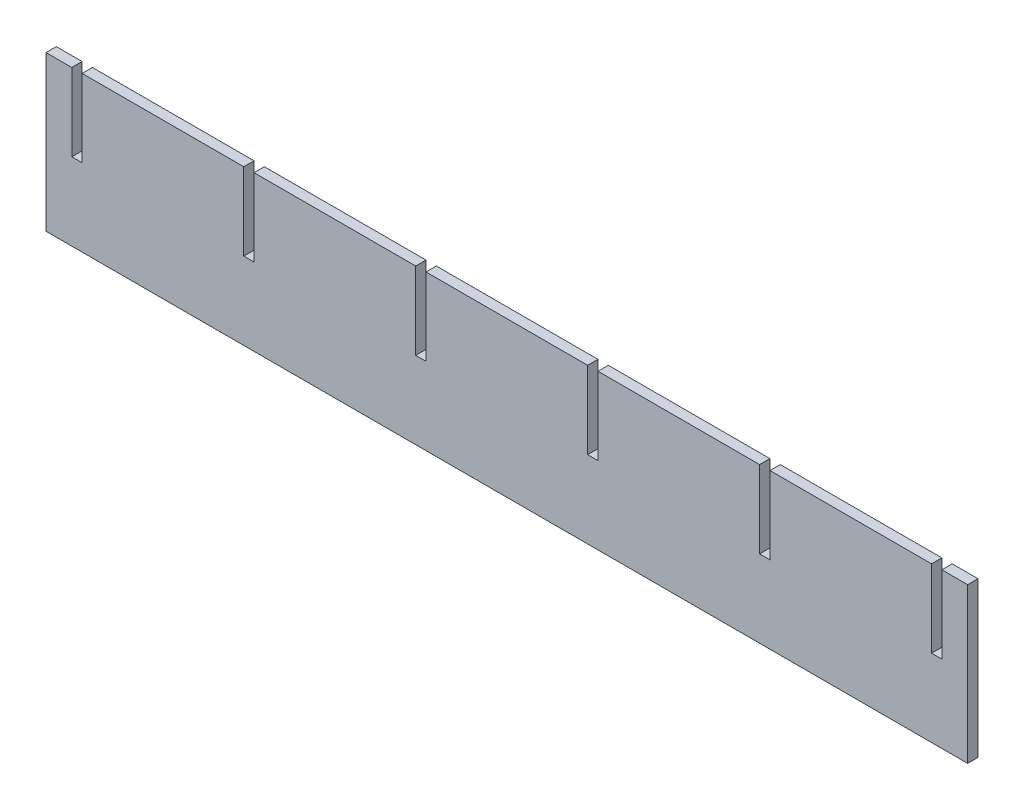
SolidWorks part; units mm, degrees
ref_plane "Alzado" through (0, 0, 0) normal (1, 0, 0) x (0, 1, 0)
ref_plane "Planta" through (0, 0, 0) normal (0, 0, 1) x (0, 1, 0)
ref_plane "Vista lateral" through (0, 0, 0) normal (0, 1, 0) x (-1, 0, 0)
sketch "Sketch3" plane through (0, 0, 0) normal (0, 0, 1) x (0, 1, 0)
  line L0 (90, -294) -> (90, -306)
  line L1 (-90, 536) -> (90, 536)
  line L2 (-90, 536) -> (-90, -536)
  line L3 (-90, -536) -> (90, -536)
  line L4 (90, 536) -> (90, -536)
  line L5 (-90, 536) -> (90, -536) construction
  line L6 (-90, -536) -> (90, 536) construction
  line L7 (90, -494) -> (0, -494)
  line L8 (90, -494) -> (90, -506)
  line L9 (90, -506) -> (0, -506)
  line L10 (0, -494) -> (0, -506)
  line L11 (90, -294) -> (0, -294)
  line L12 (0, -294) -> (0, -306)
  line L13 (90, -306) -> (0, -306)
  line L14 (90, -494) -> (90, -294) construction
  line L15 (90, -94) -> (90, -106)
  line L16 (90, -94) -> (0, -94)
  line L17 (0, -94) -> (0, -106)
  line L18 (90, -106) -> (0, -106)
  line L19 (90, 106) -> (90, 94)
  line L20 (90, 106) -> (0, 106)
  line L21 (0, 106) -> (0, 94)
  line L22 (90, 94) -> (0, 94)
  line L23 (90, 306) -> (90, 294)
  line L24 (90, 306) -> (0, 306)
  line L25 (0, 306) -> (0, 294)
  line L26 (90, 294) -> (0, 294)
  line L27 (90, 506) -> (90, 494)
  line L28 (90, 506) -> (0, 506)
  line L29 (0, 506) -> (0, 494)
  line L30 (90, 494) -> (0, 494)
  point P0 (0, 0)
extrude "Boss-Extrude1" add sketch "Sketch3" along normal blind 12 contours L4 L30 L29 L28 L1 L2 L3 L9 L10 L7 L13 L12 L11 L18 L17 L16 L22 L21 L20 L26 L25 L24
equation "\"L\"=180"
equation "\"D1@Sketch3\"=\"L\""
equation "\"W\"=12"
equation "\"D3@Sketch3\"=\"W\""
equation "\"D4@Sketch3\"=\"L\"/2"
equation "\"H\"=1700"
equation "\"D2@Sketch3\" = ( ( \"K\" * ( \"N\" - 1 ) ) + ( \"B\" * 2 ) ) + \"W\""
equation "\"B\"=30"
equation "\"D5@Sketch3\"=\"B\""
equation "\"K\"=200"
equation "\"D7@Sketch3\"=\"K\""
equation "\"D6@Sketch3\"=\"N\""
equation "\"N\"=6"
